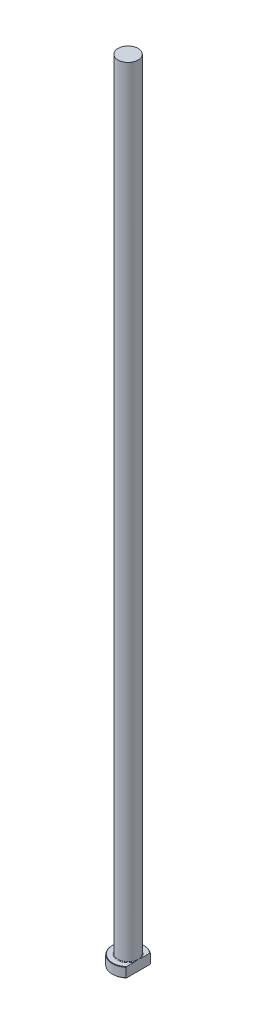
SolidWorks part; units mm, degrees
ref_plane "Front Plane" through (0, 0, 0) normal (0, 0, 1) x (1, 0, 0)
ref_plane "Top Plane" through (0, 0, 0) normal (0, 1, 0) x (1, 0, 0)
ref_plane "Right Plane" through (0, 0, 0) normal (1, 0, 0) x (0, 0, -1)
sketch "Sketch1" plane through (0, 0, 0) normal (0, 0, 1) x (1, 0, 0)
  line L0 (0, 259.9588) -> (0, -15.1925) construction
  line L1 (0, 0) -> (-8, 0)
  line L2 (-8, 0) -> (-8, 5)
  line L3 (-8, 5) -> (-5.1, 5)
  line L4 (-5.1, 5) -> (-5.1, 400)
  line L5 (-5.1, 400) -> (0, 400)
  line L6 (0, 400) -> (0, 0)
  dimension "L" = 400
  dimension "H" = 16
  dimension "T" = 5
  dimension "D" = 10.2
revolve "Revolve1" add sketch "Sketch1" angle 360 about L0
chamfer "Chamfer1" distance 0.2 angle 45 2 edges at (0, 5, 8) (0, 0, 8)
fillet "Fillet1" radius 0.3 1 edges at (0, 5, 5.1)
sketch "Sketch2" plane through (0, 0, 0) normal (0, 1, 0) x (1, 0, 0)
  line L0 (5.1, 6.1636) -> (5.1, -6.1636)
  circle A0 centre (0, 0) radius 8 construction
  arc A1 (5.1, -6.1636) -> (5.1, 6.1636) centre (0, 0) ccw
  circle A2 centre (0, 0) radius 5.1 construction
extrude "KEY" cut sketch "Sketch2" along normal through all
